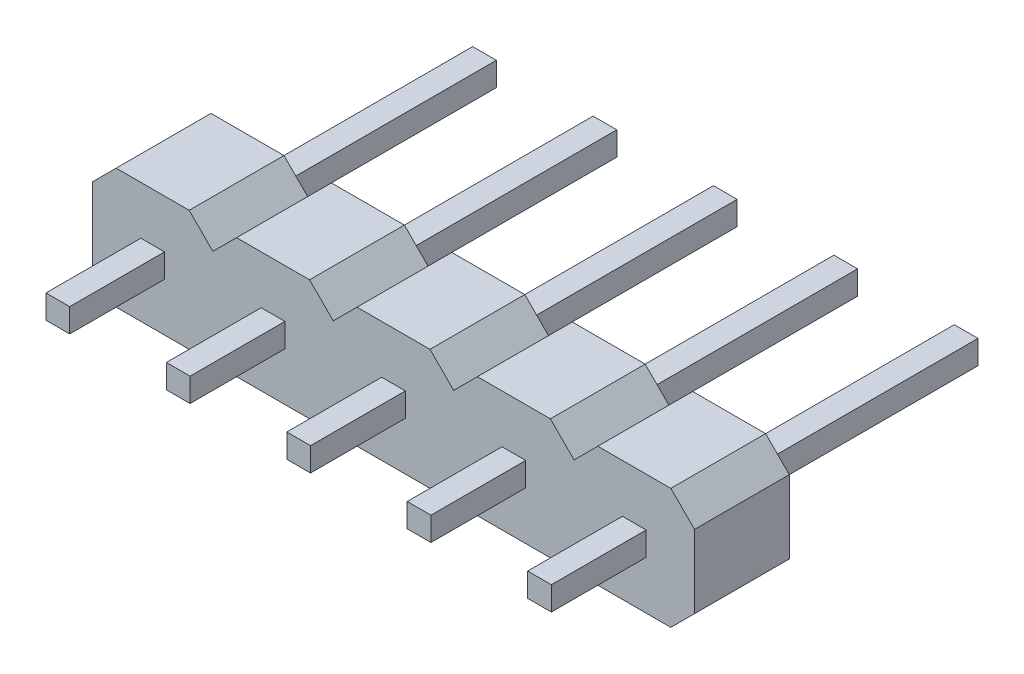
SolidWorks part; units mm, degrees
ref_plane "Front Plane" through (0, 0, 0) normal (0, 0, 1) x (1, 0, 0)
ref_plane "Top Plane" through (0, 0, 0) normal (0, 1, 0) x (1, 0, 0)
ref_plane "Right Plane" through (0, 0, 0) normal (1, 0, 0) x (0, 0, -1)
sketch "Sketch1" plane through (0, 0, 0) normal (0, 0, 1) x (1, 0, 0)
  line L0 (-8, 0.5) -> (-8.5, 0)
  line L1 (-8.5, 0) -> (-10.04, 0)
  line L2 (-8, 0.5) -> (-8, 2.04)
  line L3 (-8.5, 2.54) -> (-10.04, 2.54)
  line L4 (-10.54, 0.5) -> (-10.54, 2.04)
  line L5 (-10.04, 0) -> (-10.54, 0.5)
  line L6 (-8, 2.04) -> (-8.5, 2.54)
  line L7 (-10.04, 2.54) -> (-10.54, 2.04)
  line L10 (-10.54, 0.5) -> (-10.54, 2.04)
  line L11 (-10.54, 2.04) -> (-11.04, 2.54)
  line L12 (-10.54, 0.5) -> (-11.04, 0)
  line L13 (-11.04, 0) -> (-12.58, 0)
  line L14 (-12.58, 0) -> (-13.08, 0.5)
  line L15 (-13.08, 0.5) -> (-13.08, 2.04)
  line L16 (-12.58, 2.54) -> (-13.08, 2.04)
  line L17 (-11.04, 2.54) -> (-12.58, 2.54)
  line L18 (-13.08, 0.5) -> (-13.08, 2.04)
  line L19 (-13.08, 2.04) -> (-13.58, 2.54)
  line L20 (-13.08, 0.5) -> (-13.58, 0)
  line L21 (-13.58, 0) -> (-15.12, 0)
  line L22 (-15.12, 0) -> (-15.62, 0.5)
  line L23 (-15.62, 0.5) -> (-15.62, 2.04)
  line L24 (-15.12, 2.54) -> (-15.62, 2.04)
  line L25 (-13.58, 2.54) -> (-15.12, 2.54)
  line L26 (-15.62, 0.5) -> (-15.62, 2.04)
  line L27 (-15.62, 2.04) -> (-16.12, 2.54)
  line L28 (-15.62, 0.5) -> (-16.12, 0)
  line L29 (-16.12, 0) -> (-17.66, 0)
  line L30 (-17.66, 0) -> (-18.16, 0.5)
  line L31 (-18.16, 0.5) -> (-18.16, 2.04)
  line L32 (-17.66, 2.54) -> (-18.16, 2.04)
  line L33 (-16.12, 2.54) -> (-17.66, 2.54)
  line L34 (-18.16, 0.5) -> (-18.16, 2.04)
  line L35 (-18.16, 2.04) -> (-18.66, 2.54)
  line L36 (-18.16, 0.5) -> (-18.66, 0)
  line L37 (-18.66, 0) -> (-20.2, 0)
  line L38 (-20.2, 0) -> (-20.7, 0.5)
  line L39 (-20.7, 0.5) -> (-20.7, 2.04)
  line L40 (-20.2, 2.54) -> (-20.7, 2.04)
  line L41 (-18.66, 2.54) -> (-20.2, 2.54)
  line L226 (-10.54, 17.96) -> (-10.54, 19.5)
  line L227 (-10.54, 19.5) -> (-11.04, 20)
  line L228 (-10.54, 17.96) -> (-11.04, 17.46)
  line L229 (-11.04, 17.46) -> (-12.58, 17.46)
  line L230 (-12.58, 17.46) -> (-13.08, 17.96)
  line L231 (-13.08, 17.96) -> (-13.08, 19.5)
  line L232 (-12.58, 20) -> (-13.08, 19.5)
  line L233 (-11.04, 20) -> (-12.58, 20)
  line L234 (-13.08, 17.96) -> (-13.08, 19.5)
  line L235 (-13.08, 19.5) -> (-13.58, 20)
  line L236 (-13.08, 17.96) -> (-13.58, 17.46)
  line L237 (-13.58, 17.46) -> (-15.12, 17.46)
  line L238 (-15.12, 17.46) -> (-15.62, 17.96)
  line L239 (-15.62, 17.96) -> (-15.62, 19.5)
  line L240 (-15.12, 20) -> (-15.62, 19.5)
  line L241 (-13.58, 20) -> (-15.12, 20)
  line L242 (-15.62, 17.96) -> (-15.62, 19.5)
  line L243 (-15.62, 19.5) -> (-16.12, 20)
  line L244 (-15.62, 17.96) -> (-16.12, 17.46)
  line L245 (-16.12, 17.46) -> (-17.66, 17.46)
  line L246 (-17.66, 17.46) -> (-18.16, 17.96)
  line L247 (-18.16, 17.96) -> (-18.16, 19.5)
  line L248 (-17.66, 20) -> (-18.16, 19.5)
  line L249 (-16.12, 20) -> (-17.66, 20)
  line L250 (-18.16, 17.96) -> (-18.16, 19.5)
  line L251 (-18.16, 19.5) -> (-18.66, 20)
  line L252 (-18.16, 17.96) -> (-18.66, 17.46)
  line L253 (-18.66, 17.46) -> (-20.2, 17.46)
  line L254 (-20.2, 17.46) -> (-20.7, 17.96)
  line L255 (-20.7, 17.96) -> (-20.7, 19.5)
  line L256 (-20.2, 20) -> (-20.7, 19.5)
  line L257 (-18.66, 20) -> (-20.2, 20)
  line L258 (-8, 17.96) -> (-8, 19.5)
  line L259 (-8, 19.5) -> (-8.5, 20)
  line L260 (-8, 17.96) -> (-8.5, 17.46)
  line L261 (-8.5, 17.46) -> (-10.04, 17.46)
  line L262 (-10.04, 17.46) -> (-10.54, 17.96)
  line L263 (-10.54, 17.96) -> (-10.54, 19.5)
  line L264 (-10.04, 20) -> (-10.54, 19.5)
  line L265 (-8.5, 20) -> (-10.04, 20)
  point P0 (-8, 0)
  point P1 (-10.54, 2.54)
  point P2 (-8, 2.54)
  point P3 (-10.54, 0)
  dimension "D1" = 2.54
  dimension "D3" = 2.54
  dimension "D4" = 5
  dimension "D5" = 2
extrude "Header blocks" add sketch "Sketch1" along normal blind 2 contours L35 L41 L40 L39 L38 L37 L36 L31 | L27 L33 L32 L31 L30 L29 L28 L23 | L19 L25 L24 L23 L22 L21 L20 L15 | L11 L17 L16 L15 L14 L13 L12 L4
sketch "Sketch2" plane through (0, 0, 2) normal (0, 0, 1) x (1, 0, 0)
  line L0 (-8, 0.5) -> (-8, 2.04) construction
  line L1 (-9.52, 1.02) -> (-9.02, 1.02)
  line L2 (-9.52, 1.02) -> (-9.52, 1.52)
  line L3 (-9.52, 1.52) -> (-9.02, 1.52)
  line L4 (-9.02, 1.02) -> (-9.02, 1.52)
  line L5 (-8.5, 0) -> (-10.04, 0) construction
  line L6 (-12.06, 1.02) -> (-12.06, 1.52)
  line L7 (-12.06, 1.02) -> (-11.56, 1.02)
  line L8 (-11.56, 1.02) -> (-11.56, 1.52)
  line L9 (-12.06, 1.52) -> (-11.56, 1.52)
  line L10 (-14.6, 1.02) -> (-14.6, 1.52)
  line L11 (-14.6, 1.02) -> (-14.1, 1.02)
  line L12 (-14.1, 1.02) -> (-14.1, 1.52)
  line L13 (-14.6, 1.52) -> (-14.1, 1.52)
  line L14 (-17.14, 1.02) -> (-17.14, 1.52)
  line L15 (-17.14, 1.02) -> (-16.64, 1.02)
  line L16 (-16.64, 1.02) -> (-16.64, 1.52)
  line L17 (-17.14, 1.52) -> (-16.64, 1.52)
  line L18 (-19.68, 1.02) -> (-19.68, 1.52)
  line L19 (-19.68, 1.02) -> (-19.18, 1.02)
  line L20 (-19.18, 1.02) -> (-19.18, 1.52)
  line L21 (-19.68, 1.52) -> (-19.18, 1.52)
  point P4 (-9.02, 1.27)
  point P7 (-8, 1.27)
  point P10 (-9.27, 0)
  point P11 (-9.27, 1.02)
  dimension "D1" = 0.5
  dimension "D2" = 5
extrude "Pins" add sketch "Sketch2" along normal blind 2 and the other way blind 7
